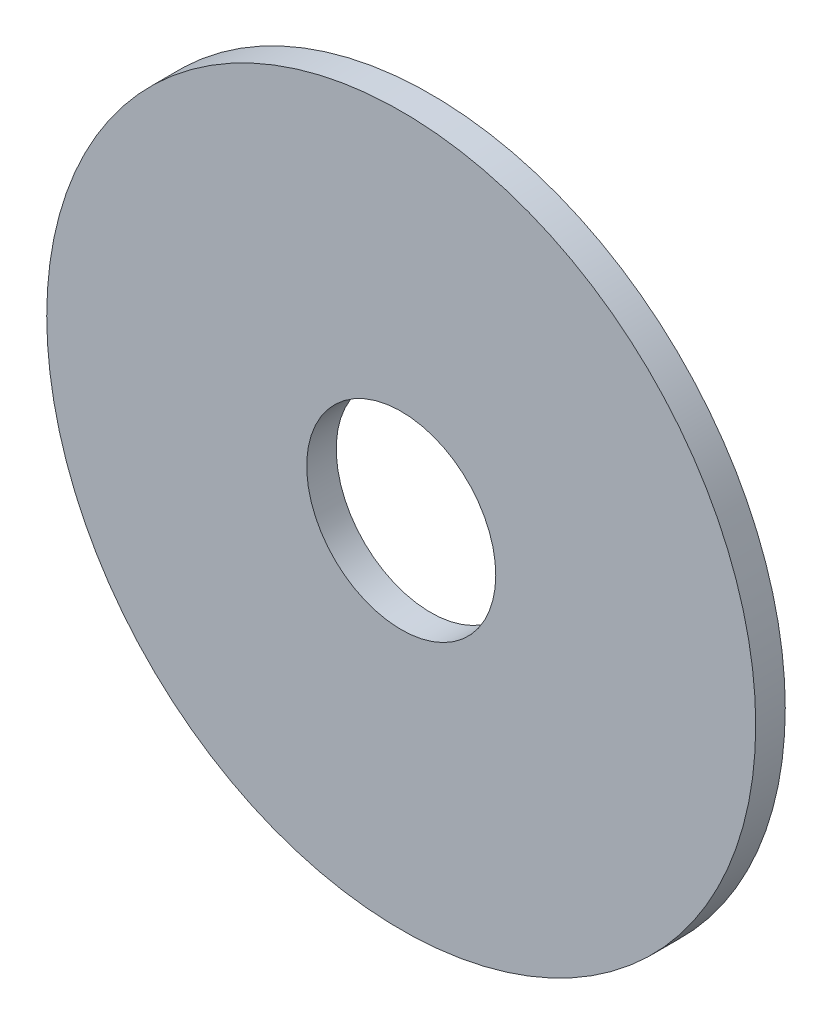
SolidWorks part; units mm, degrees
ref_plane "Plan de face" through (0, 0, 0) normal (0, 0, 1) x (1, 0, 0)
ref_plane "Plan de dessus" through (0, 0, 0) normal (0, 1, 0) x (1, 0, 0)
ref_plane "Plan de droite" through (0, 0, 0) normal (1, 0, 0) x (0, 0, -1)
sketch "Esquisse1" plane through (0, 0, 0) normal (0, 0, 1) x (1, 0, 0)
  circle A0 centre (0, 0) radius 6
  circle A1 centre (0, 0) radius 1.6
extrude "Extrusion1" add sketch "Esquisse1" along normal blind 0.5
